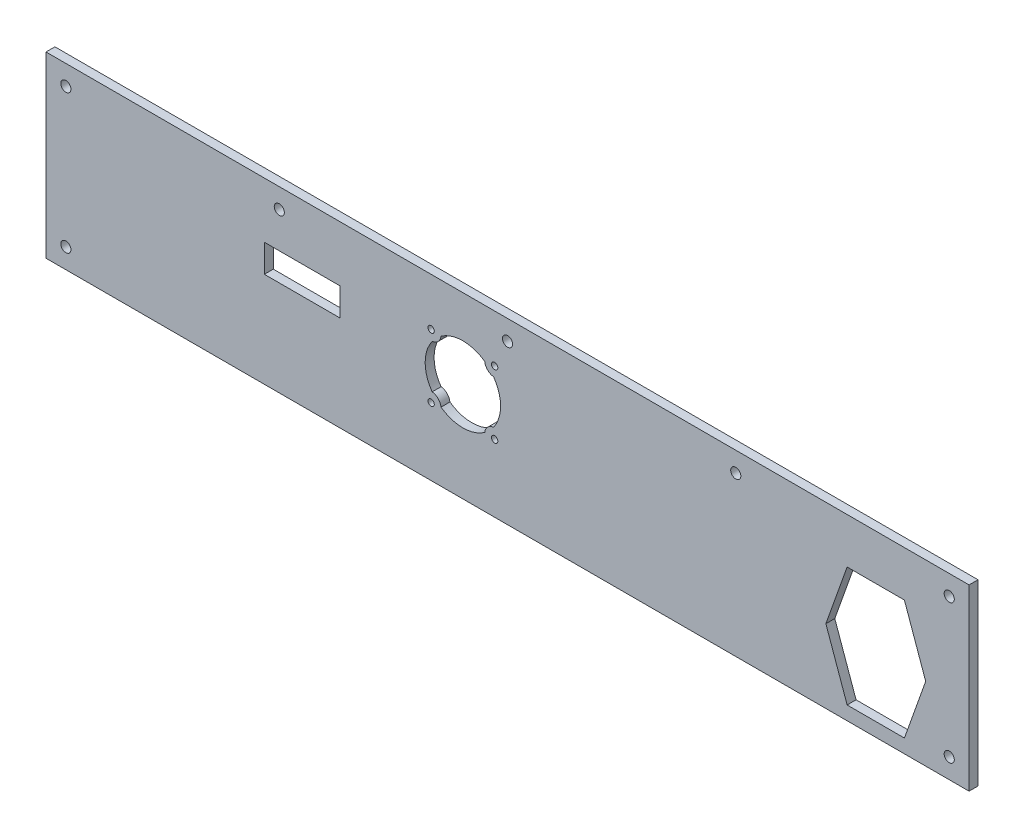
SolidWorks part; units mm, degrees
ref_plane "Front Plane" through (0, 0, 0) normal (0, 0, 1) x (1, 0, 0)
ref_plane "Top Plane" through (0, 0, 0) normal (0, 1, 0) x (1, 0, 0)
ref_plane "Right Plane" through (0, 0, 0) normal (1, 0, 0) x (0, 0, -1)
sketch "Sketch1" plane through (0, 0, 0) normal (0, 0, 1) x (1, 0, 0)
  line L0 (-222.5, 45) -> (-222.5, -45) construction
  line L1 (-232.5, -45) -> (232.5, -45)
  line L2 (-232.5, -45) -> (-232.5, 45)
  line L3 (-232.5, 45) -> (232.5, 45)
  line L4 (232.5, -45) -> (232.5, 45)
  line L5 (-232.5, -45) -> (232.5, 45) construction
  line L6 (-232.5, 45) -> (232.5, -45) construction
  line L7 (0, 45) -> (0, -45) construction
  line L8 (-232.5, 35) -> (2.55, 35) construction
  circle A0 centre (-222.5, 35) radius 2.55
  circle A1 centre (-222.5, -35) radius 2.55
  circle A2 centre (0, 35) radius 2.55
  circle A3 centre (-114.975, 35) radius 2.55
  circle A4 centre (222.5, -35) radius 2.55
  circle A5 centre (222.5, 35) radius 2.55
  circle A6 centre (114.975, 35) radius 2.55
  point P0 (0, 0)
  point P17 (-114.975, 35)
  dimension "D4" = 5.1
  dimension "D5" = 10
  dimension "D6" = 10
  dimension "D7" = 10
  dimension "D1" = 465
  dimension "D2" = 90
  dimension "D3" = 10
extrude "Boss-Extrude1" add sketch "Sketch1" along normal mid plane 4.4958
sketch "Sketch2" plane through (0, 0, 2.2479) normal (0, 0, 1) x (1, 0, 0)
  line L1 (-232.5, -45) -> (232.5, -45) construction
  line L2 (-122.5, 17) -> (-84.5, 17)
  line L3 (-122.5, 17) -> (-122.5, 3)
  line L4 (-122.5, 3) -> (-84.5, 3)
  line L10 (-84.5, 17) -> (-84.5, 3)
  line L11 (-232.5, 45) -> (-232.5, -45) construction
  line L23 (-38.5, -11) -> (-6.5, -11) construction
  line L24 (-38.5, -11) -> (-38.5, 21) construction
  line L25 (-38.5, 21) -> (-6.5, 21) construction
  line L26 (-6.5, -11) -> (-6.5, 21) construction
  line L27 (-38.5, -11) -> (-6.5, 21) construction
  line L28 (-38.5, 21) -> (-6.5, -11) construction
  line L29 (-42.5, -15) -> (-2.5, -15) construction
  line L30 (-42.5, -15) -> (-42.5, 25) construction
  line L31 (-42.5, 25) -> (-2.5, 25) construction
  line L32 (-2.5, -15) -> (-2.5, 25) construction
  line L33 (-42.5, -15) -> (-2.5, 25) construction
  line L34 (-42.5, 25) -> (-2.5, -15) construction
  line L45 (210.6369, -8) -> (199.9233, 22.1)
  line L46 (199.9233, -38.1) -> (210.6369, -8)
  line L47 (171.0767, -38.1) -> (199.9233, -38.1)
  line L48 (160.3631, -8) -> (171.0767, -38.1)
  line L49 (171.0767, 22.1) -> (160.3631, -8)
  line L50 (199.9233, 22.1) -> (171.0767, 22.1)
  line L51 (210.6369, -8) -> (199.9233, 22.1)
  line L52 (199.9233, -38.1) -> (210.6369, -8)
  line L53 (171.0767, -38.1) -> (199.9233, -38.1)
  line L54 (160.3631, -8) -> (171.0767, -38.1)
  line L55 (171.0767, 22.1) -> (160.3631, -8)
  line L56 (199.9233, 22.1) -> (171.0767, 22.1)
  arc A0 (-33.528, -10.472) -> (-11.472, -10.472) centre (-22.5, 5) ccw
  circle A1 centre (-6.5, 21) radius 1.6
  circle A2 centre (-38.5, 21) radius 1.6
  circle A3 centre (-38.5, -11) radius 1.6
  circle A4 centre (-6.5, -11) radius 1.6
  arc A5 (-37.972, 16.028) -> (-37.972, -6.028) centre (-22.5, 5) ccw
  arc A6 (-11.472, 20.472) -> (-7.028, 16.028) centre (-6.5, 21) ccw
  arc A7 (-11.472, 20.472) -> (-33.528, 20.472) centre (-22.5, 5) ccw
  arc A8 (-7.028, -6.028) -> (-7.028, 16.028) centre (-22.5, 5) ccw
  arc A10 (-37.972, 16.028) -> (-33.528, 20.472) centre (-38.5, 21) ccw
  arc A11 (-33.528, -10.472) -> (-37.972, -6.028) centre (-38.5, -11) ccw
  arc A12 (-7.028, -6.028) -> (-11.472, -10.472) centre (-6.5, -11) ccw
  dimension "D14" = 3.2
  dimension "D15" = 38
  dimension "D16" = 5
  dimension "D2" = 14
  dimension "D3" = 48
  dimension "D4" = 110
  dimension "D5" = 38
  dimension "D6" = 210
  dimension "D7" = 50
  dimension "D8" = 0.6
  dimension "D10" = 32
  dimension "D11" = 32
  dimension "D12" = 40
  dimension "D13" = 40
extrude "Cut-Extrude1" cut sketch "Sketch2" against normal up to next
